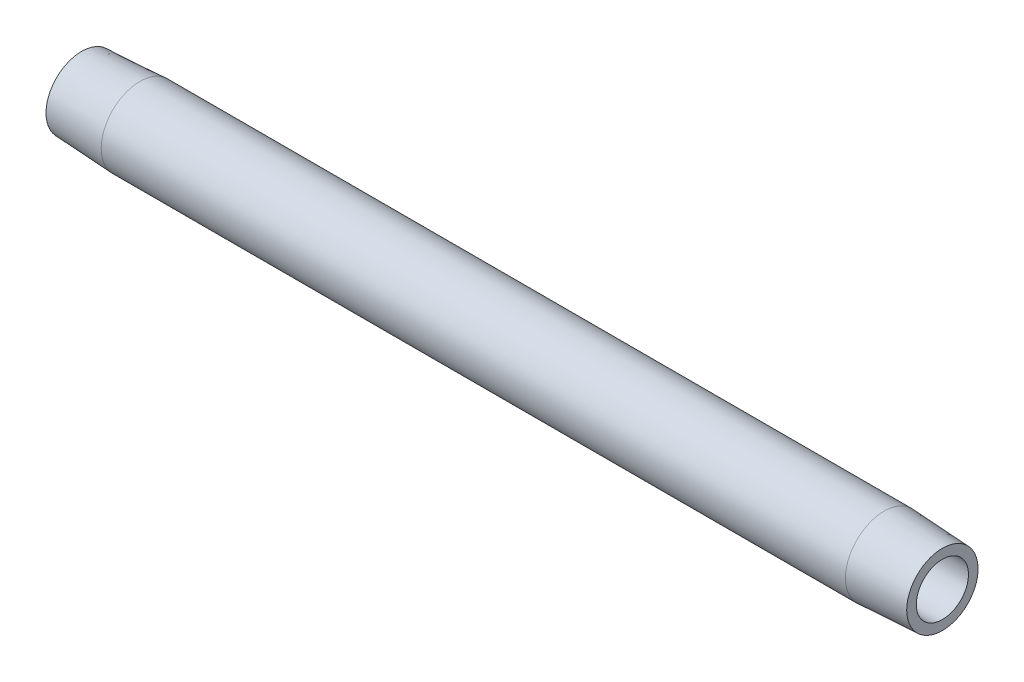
SolidWorks part; units mm, degrees
ref_plane "Front Plane" through (0, 0, 0) normal (0, 0, 1) x (1, 0, 0)
ref_plane "Top Plane" through (0, 0, 0) normal (0, 1, 0) x (1, 0, 0)
ref_plane "Right Plane" through (0, 0, 0) normal (1, 0, 0) x (0, 0, -1)
sketch "Sketch1" plane through (0, 0, 0) normal (0, 1, 0) x (1, 0, 0)
  line L6 (152.4, 4.6228) -> (0, 4.6228)
  line L7 (10.3124, 6.858) -> (0, 6.3175)
  line L8 (0, 6.3175) -> (0, 4.6228)
  line L9 (142.0876, 6.858) -> (10.3124, 6.858)
  line L10 (152.4, 6.3175) -> (142.0876, 6.858)
  line L11 (152.4, 4.6228) -> (152.4, 6.3175)
  line L12 (-6.376, 0) -> (49993.624, 0) construction
  dimension "D1" = 9.2456
  dimension "D2" = 13.716
  dimension "D3" = 3
  dimension "D4" = 3
  dimension "D5" = 152.4
  dimension "D6" = 10.3124
  dimension "D7" = 10.3124
revolve "Revolve1" add sketch "Sketch1" angle 360 about L12
